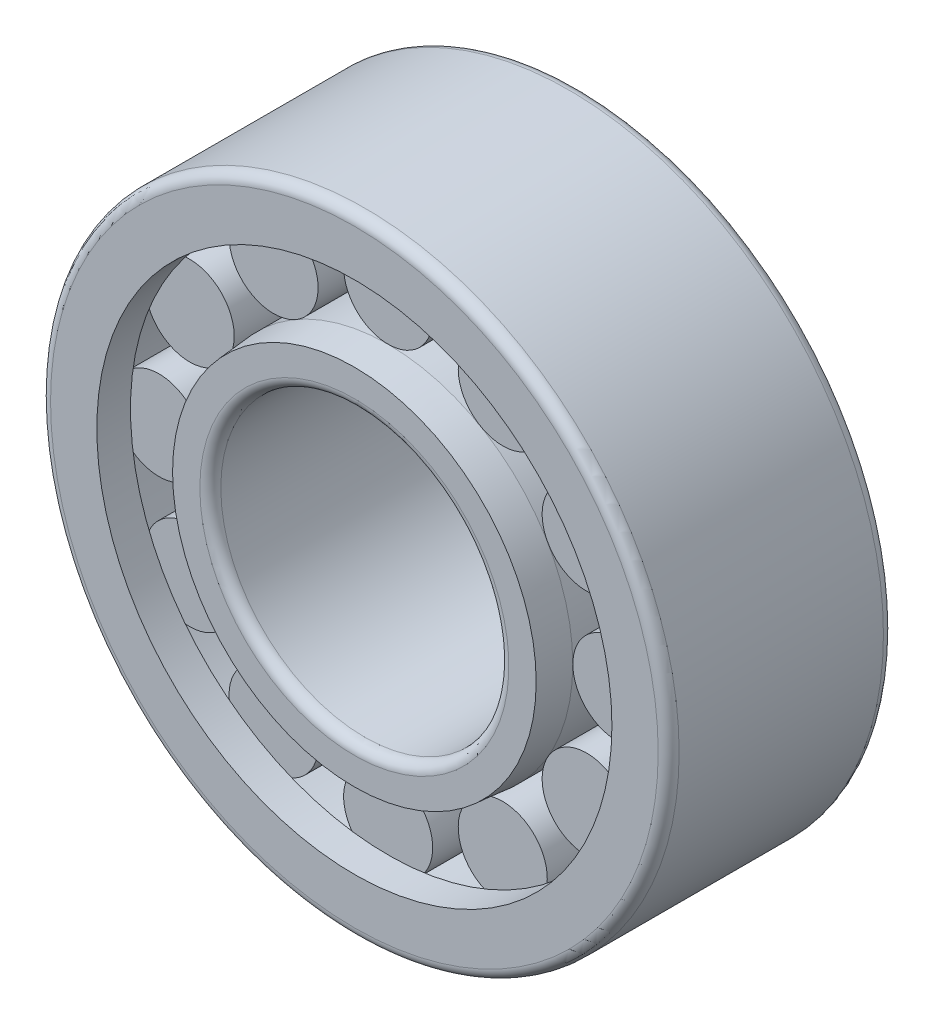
SolidWorks part; units mm, degrees
ref_plane "Front Plane" through (0, 0, 0) normal (0, 0, 1) x (1, 0, 0)
ref_plane "Top Plane" through (0, 0, 0) normal (0, 1, 0) x (1, 0, 0)
ref_plane "Right Plane" through (0, 0, 0) normal (1, 0, 0) x (0, 0, -1)
sketch "BaseSke" plane through (0, 0, 0) normal (1, 0, 0) x (0, 0, -1)
  line L0 (-47.2296, 0) -> (24.6132, 0) construction
  line L1 (-47.2296, 43.75) -> (24.6132, 43.75) construction
  line L2 (0, 129.5214) -> (0, -86.3012) construction
  line L3 (-15.05, 43.75) -> (-15.05, 52.25) construction
  line L4 (-21.5, 60) -> (21.5, 60) construction
  line L5 (-21.5, 27.5) -> (21.5, 27.5) construction
  line L6 (-15.05, 35.25) -> (15.05, 35.25)
  line L7 (-15.05, 35.25) -> (-15.05, 43.75)
  line L8 (-15.05, 43.75) -> (15.05, 43.75)
  line L9 (15.05, 35.25) -> (15.05, 43.75)
  line L10 (-15.05, 52.25) -> (15.05, 52.25) construction
  line L11 (15.05, 52.25) -> (15.05, 43.75) construction
  dimension "D2" = 30.1
  dimension "D1" = 87.5
  dimension "Bearing_Thickness" = 43
  dimension "Bearing_Outside_Diameter" = 120
  dimension "Bearing_Inside_Diameter" = 55
  dimension "Diameter_Fw" = 70.5
revolve "Roller" add sketch "BaseSke" angle 360 about L8
sketch "OuterRaceSke" plane through (0, 0, 0) normal (1, 0, 0) x (0, 0, -1)
  line L0 (0, 0) -> (0, 87.5396) construction
  line L1 (-21.5, 60) -> (21.5, 60)
  line L2 (-21.5, 60) -> (-21.5, 49.1667)
  line L3 (-21.5, 49.1667) -> (-15.075, 49.1667)
  line L4 (21.5, 60) -> (21.5, 49.1667)
  line L5 (-50.3916, 0) -> (55.2197, 0) construction
  line L6 (-15.05, 52.25) -> (15.05, 52.25) construction
  line L7 (15.075, 49.1667) -> (21.5, 49.1667)
  line L9 (-15.075, 49.1667) -> (-15.075, 52.23)
  line L10 (-15.075, 52.23) -> (15.075, 52.23)
  line L11 (15.075, 49.1667) -> (15.075, 52.23)
  dimension "D1" = 30.15
  dimension "D2" = 98.3333
  dimension "D3" = 0.02
revolve "OuterRace" add sketch "OuterRaceSke" angle 360 about L5
sketch "InnerRaceSke" plane through (0, 0, 0) normal (1, 0, 0) x (0, 0, -1)
  line L0 (-70.8626, 0) -> (113.5527, 0) construction
  line L1 (0, 58.441) -> (0, -70.8113) construction
  line L2 (-21.5, 27.5) -> (21.5, 27.5)
  line L3 (-21.5, 27.5) -> (-21.5, 38.3333)
  line L4 (-15.075, 38.3333) -> (-15.075, 35.27)
  line L5 (-15.075, 38.3333) -> (-21.5, 38.3333)
  line L6 (0, 129.5214) -> (0, -86.3012) construction
  line L7 (-15.075, 35.27) -> (15.075, 35.27)
  line L9 (21.5, 27.5) -> (21.5, 38.3333)
  line L10 (15.075, 38.3333) -> (21.5, 38.3333)
  line L11 (15.075, 35.27) -> (15.075, 38.3333)
  line L13 (-15.05, 35.25) -> (15.05, 35.25) construction
  point P17 (0, 27.5)
  dimension "D2" = 0.02
  dimension "D1" = 30.15
  dimension "D3" = 76.6667
revolve "InnerRace" add sketch "InnerRaceSke" angle 360 about L0
fillet "Fillet1" radius 2 4 edges at (27.5, 0, 21.5) (60, 0, -21.5) (60, 0, 21.5) (27.5, 0, -21.5)
sketch "CutGrooveSke" plane through (0, 0, 0) normal (1, 0, 0) x (0, 0, -1)
  line L0 (-51.8407, 0) -> (83.8302, 0) construction
  line L1 (-10.75, -78.8) -> (-12.9, -78.8)
  line L2 (-10.75, -78.8) -> (-10.75, -58.8)
  line L3 (-10.75, -58.8) -> (-12.9, -58.8)
  line L4 (-12.9, -78.8) -> (-12.9, -58.8)
  dimension "D1" = 58.8
  dimension "D2" = 10.75
  dimension "D3" = 2.15
  dimension "D4" = 20
revolve "CutGroove" [suppressed] cut sketch "CutGrooveSke" angle 360 about L0
sketch "TaperSke" plane through (0, 0, 0) normal (1, 0, 0) x (0, 0, -1)
  line L0 (-21.5, 27.5) -> (21.5, 27.5)
  line L1 (21.5, 27.5) -> (21.5, 31.0833)
  line L2 (21.5, 31.0833) -> (-21.5, 27.5)
  line L7 (-41.2502, 0) -> (40.8606, 0) construction
  dimension "Taper" = 3.5833
revolve "Taper" [suppressed] cut sketch "TaperSke" angle 360 about L7
fillet "Fillet2" [suppressed] radius 2
sketch "NFSke" plane through (0, 0, 0) normal (1, 0, 0) x (0, 0, -1)
  line L0 (-54.6114, 0) -> (63.7655, 0) construction
  line L1 (21.5, 52.7921) -> (15.075, 52.23)
  line L2 (15.075, 52.23) -> (15.075, 49.1667)
  line L3 (15.075, 49.1667) -> (21.5, 49.1667)
  line L4 (21.5, 49.1667) -> (21.5, 52.7921)
  dimension "D1" = 5
revolve "NF" [suppressed] cut sketch "NFSke" angle 360 about L0
mirror "N" [suppressed] about plane through (0, 0, 0) normal (0, 0, 1)
sketch "NJSke" plane through (0, 0, 0) normal (1, 0, 0) x (0, 0, -1)
  line L0 (-35.6078, 0) -> (44.429, 0) construction
  line L1 (21.5, 38.3333) -> (15.075, 38.3333)
  line L2 (15.075, 38.3333) -> (15.075, 35.27)
  line L3 (15.075, 35.27) -> (21.5, 34.7079)
  line L4 (21.5, 34.7079) -> (21.5, 38.3333)
  dimension "D1" = 5
revolve "NJ" cut sketch "NJSke" angle 360 about L0
mirror "NU" about plane through (0, 0, 0) normal (0, 0, 1) of "NJ"
pattern_circular "CirPatternBall" count 12 over 360 about axis through (0, 0, 0) along (0, 0, 1) of "Roller"
sketch "SimplifiedSke" plane through (0, 0, 0) normal (1, 0, 0) x (0, 0, -1)
  line L0 (37.5911, 0) -> (-37.5911, 0) construction
  line L1 (-13.1351, 43.75) -> (13.151, 43.75) construction
  line L2 (-15.05, 52.25) -> (15.05, 52.25)
  line L3 (-15.05, 52.25) -> (-15.05, 35.25)
  line L4 (-15.05, 35.25) -> (15.05, 35.25)
  line L5 (15.05, 52.25) -> (15.05, 35.25)
  line L6 (-47.2296, 43.75) -> (24.6132, 43.75) construction
revolve "Simplified" [suppressed] add sketch "SimplifiedSke" angle 360 about L0
equation "\"D2@BaseSke\" = \"Bearing_Thickness@BaseSke\"*0.7"
equation "\"D1@BaseSke\" =  ( \"Bearing_Outside_Diameter@BaseSke\" + \"Bearing_Inside_Diameter@BaseSke\" )  / 2"
equation "\"D1@OuterRaceSke\" = \"Bearing_Thickness@BaseSke\"*0.7+0.05"
equation "\"D2@OuterRaceSke\" =\"Bearing_Outside_Diameter@BaseSke\" -  ( \"Bearing_Outside_Diameter@BaseSke\" - \"Bearing_Inside_Diameter@BaseSke\"  )/ 3 "
equation "\"D1@InnerRaceSke\" = \"Bearing_Thickness@BaseSke\"*0.7+0.05"
equation "\"D3@InnerRaceSke\" = \"Bearing_Inside_Diameter@BaseSke\" +  ( \"Bearing_Outside_Diameter@BaseSke\" - \"Bearing_Inside_Diameter@BaseSke\" ) / 3 "
equation "\"D1@CirPatternBall\" =  int(  ( \"Bearing_Outside_Diameter@BaseSke\" + \"Bearing_Inside_Diameter@BaseSke\" )  / 2 *  pi  /  ( \"Bearing_Outside_Diameter@BaseSke\" - \"Bearing_Inside_Diameter@BaseSke\" ) * 3 ) "
equation "\"D1@CutGrooveSke\" = \"Bearing_Outside_Diameter@BaseSke\" * 0.49"
equation "\"D2@CutGrooveSke\" = \"Bearing_Thickness@BaseSke\" *0.25"
equation "\"D3@CutGrooveSke\" = \"Bearing_Thickness@BaseSke\"/20"
equation "\"Taper@TaperSke\" = \"Bearing_Thickness@BaseSke\"/12"
equation "\"D1@Fillet2\" = \"Fillet_radius@Fillet1\""
